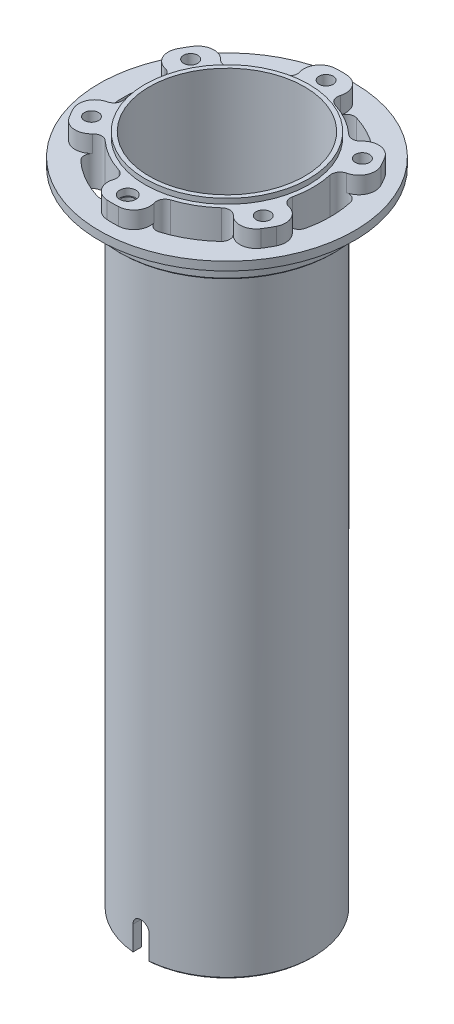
SolidWorks part; units mm, degrees
ref_plane "Front Plane" through (0, 0, 0) normal (0, 0, 1) x (1, 0, 0)
ref_plane "Top Plane" through (0, 0, 0) normal (0, 1, 0) x (1, 0, 0)
ref_plane "Right Plane" through (0, 0, 0) normal (1, 0, 0) x (0, 0, -1)
sketch "Sketch1" plane through (0, 0, 0) normal (0, 0, 1) x (1, 0, 0)
  line L0 (0, 0) -> (0, 40.0271) construction
  line L1 (-24.1237, 0) -> (-33.655, 0)
  line L2 (-31.7373, -7.62) -> (-33.655, -7.62)
  line L3 (-24.1237, 0) -> (-24.1237, 1.524)
  line L4 (-33.655, 0) -> (-33.655, -5)
  line L5 (-24.1237, 1.524) -> (-22.86, 1.524)
  line L6 (-22.86, 1.524) -> (-22.86, 0)
  line L7 (-22.86, 0) -> (-22.86, -196.85)
  line L8 (-22.86, -196.85) -> (-25.4, -196.85)
  line L9 (-33.655, -5) -> (-37.592, -5)
  line L10 (-37.592, -5) -> (-37.592, -7.5)
  line L11 (-37.592, -7.5) -> (-33.655, -7.5)
  line L12 (-33.655, -7.5) -> (-33.655, -7.62)
  line L17 (-31.7373, -13.97) -> (-25.4, -13.97)
  line L18 (0, 0) -> (-22.86, 0) construction
  line L19 (-25.4, -196.85) -> (-25.4, -13.97)
  line L20 (-31.7373, -7.62) -> (-31.7373, -13.97)
  dimension "D2" = 48.2473
  dimension "D3" = 45.72
  dimension "D4" = 6.35
  dimension "D5" = 13.97
  dimension "D6" = 5
  dimension "D7" = 2.5
  dimension "D8" = 75.184
  dimension "D9" = 1.524
  dimension "D10" = 67.31
  dimension "D11" = 50.8
  dimension "D12" = 196.85
  dimension "D14" = 63.4746
revolve "Revolve1" add sketch "Sketch1" angle 360 about L0
hole_wizard "#8-32 Tapped Hole1" positions "Sketch8" profile "Sketch7" tap size "#8-32" standard "ANSI Inch"
sketch "Sketch8" plane through (0, 0, 0) normal (0, 1, 0) x (1, 0, 0)
  line L0 (0, -28.575) -> (0, 0) construction
  point P0 (0, -28.575)
  dimension "D1" = 28.575
sketch "Sketch7" plane through (0, 0, 28.575) normal (1, 0, 0) x (0, 0, 1)
  line L0 (0, 0) -> (0, 12.446)
  line L1 (0, 12.446) -> (1.7272, 12.446)
  line L2 (1.7272, 12.446) -> (1.7272, 0)
  line L5 (1.7272, 0) -> (0, 0)
  line L10 (0, 12.446) -> (-1.7272, 12.446) construction
  line L11 (0, -6.35) -> (0, 107.95) construction
  dimension "Tap Drill Dia." = 3.4544
  dimension "Tap Drill Depth" = 12.446
  dimension "Drill Angle" = 180
hole_wizard "#8-32 Tapped Hole2" positions "Sketch10" profile "Sketch9" tap size "#8-32" standard "ANSI Inch"
sketch "Sketch10" plane through (0, 0, 0) normal (0, 1, 0) x (1, 0, 0)
  line L0 (0, -39.37) -> (0, 0) construction
  line L1 (0, 0) -> (25.2966, -14.605) construction
  point P0 (25.2966, -14.605)
  dimension "D1" = 29.21
  dimension "D2" = 60
sketch "Sketch9" plane through (25.2966, 0, 14.605) normal (1, 0, 0) x (0, 0, 1)
  line L0 (0, 0) -> (0, 9.4198)
  line L1 (0, 9.4198) -> (1.7272, 8.382)
  line L2 (1.7272, 8.382) -> (1.7272, 6.35)
  line L3 (1.7272, 6.35) -> (2.0828, 6.35)
  line L4 (2.0828, 6.35) -> (2.0828, 0)
  line L5 (2.0828, 0) -> (0, 0)
  line L10 (0, 9.4198) -> (-1.7272, 8.382) construction
  line L11 (0, -6.35) -> (0, 107.95) construction
  dimension "Tap Drill Dia." = 3.4544
  dimension "Tap Drill Depth" = 8.382
  dimension "Thread Major Dia." = 4.1656
  dimension "Thread Depth" = 6.35
  dimension "Drill Angle" = 118
fillet "Fillet1" radius 0.762 1 edges at (0, -13.97, -25.4)
sketch "Sketch11" plane through (0, 0, 0) normal (0, 1, 0) x (1, 0, 0)
  line L0 (18.876, -20.5995) -> (0, 0) construction
  line L1 (0, 0) -> (8.4017, -26.6469) construction
  line L2 (0, 0) -> (0, -42.7723) construction
  line L3 (0, 0) -> (25.2966, -14.605) construction
  line L4 (0, -27.94) -> (24.1967, -13.97) construction
  line L5 (15.24, -26.3965) -> (12.0984, -20.955) construction
  line L6 (0, 0) -> (20.0637, -18.2464) construction
  line L7 (0, 0) -> (5.77, -26.4989) construction
  arc A0 (20.592, -22.4722) -> (17.16, -18.7268) centre (18.876, -20.5995) ccw
  arc A1 (9.1655, -29.0693) -> (20.592, -22.4722) centre (0, 0) ccw
  circle A2 centre (0, 0) radius 27.94 construction
  arc A3 (7.6379, -24.2244) -> (9.1655, -29.0693) centre (8.4017, -26.6469) ccw
  arc A4 (7.6379, -24.2244) -> (17.16, -18.7268) centre (0, 0) ccw
  dimension "D1" = 2.54
  dimension "D2" = 30.48
  dimension "D4" = 25
extrude "Cut-Extrude1" cut sketch "Sketch11" against normal blind 19.05
sketch "Sketch12" plane through (0, 0, 0) normal (0, 1, 0) x (1, 0, 0)
  line L0 (20.7487, -18.8835) -> (24.2682, -15.6585) construction
  line L1 (0, 0) -> (15.24, -26.3965) construction
  line L2 (5.9793, -27.4106) -> (1.4266, -28.8461) construction
  arc A0 (20.7487, -18.8835) -> (28.2793, -18.2466) centre (24.2682, -15.6585) ccw
  circle A1 centre (0, 0) radius 33.655 construction
  arc A2 (20.592, -22.4722) -> (17.16, -18.7268) centre (18.876, -20.5995) ccw construction
  arc A3 (1.6624, -33.6139) -> (28.2793, -18.2466) centre (0, 0) ccw
  arc A4 (9.1655, -29.0693) -> (20.592, -22.4722) centre (0, 0) ccw construction
  arc A5 (5.9793, -27.4106) -> (1.6624, -33.6139) centre (1.4266, -28.8461) cw
  arc A6 (5.9793, -27.4106) -> (20.7487, -18.8835) centre (0, 0) ccw
extrude "Cut-Extrude2" cut sketch "Sketch12" against normal up to surface (5 mm away)
pattern_circular "CirPattern1" count 6 over 360 about axis through (0, 0, 0) along (0, 1, 0) of "#8-32 Tapped Hole2"
pattern_circular "CirPattern2" count 6 over 360 about axis through (0, 0, 0) along (0, 1, 0) of "Cut-Extrude1", "Cut-Extrude2"
sketch "Sketch13" plane through (0, 0, 0) normal (0, 1, 0) x (1, 0, 0)
  circle A0 centre (0, -29.21) radius 2.3813
  dimension "D1" = 4.7625
extrude "Cut-Extrude3" cut sketch "Sketch13" against normal blind 2.032
sketch "Sketch14" plane through (0, 0, 0) normal (0, 0, 1) x (1, 0, 0)
  line L0 (0, 0) -> (0, -215.7438) construction
  line L1 (2.3813, -189.23) -> (2.3813, -196.85)
  line L2 (2.3813, -196.85) -> (-2.3813, -196.85)
  line L3 (-2.3813, -196.85) -> (-2.3813, -189.23)
  line L4 (-22.86, -196.85) -> (22.86, -196.85) construction
  arc A0 (2.3813, -189.23) -> (-2.3813, -189.23) centre (0, -189.23) ccw
  dimension "D1" = 4.7625
  dimension "D2" = 7.62
extrude "Cut-Extrude4" cut sketch "Sketch14" along normal through all
chamfer "Chamfer1" distance 0.508 angle 45 4 edges at (0, -13.97, -31.7373) (0, -196.85, -25.4) (-2.3813, -196.85, 24.0119) (2.3813, -196.85, 24.0119)
